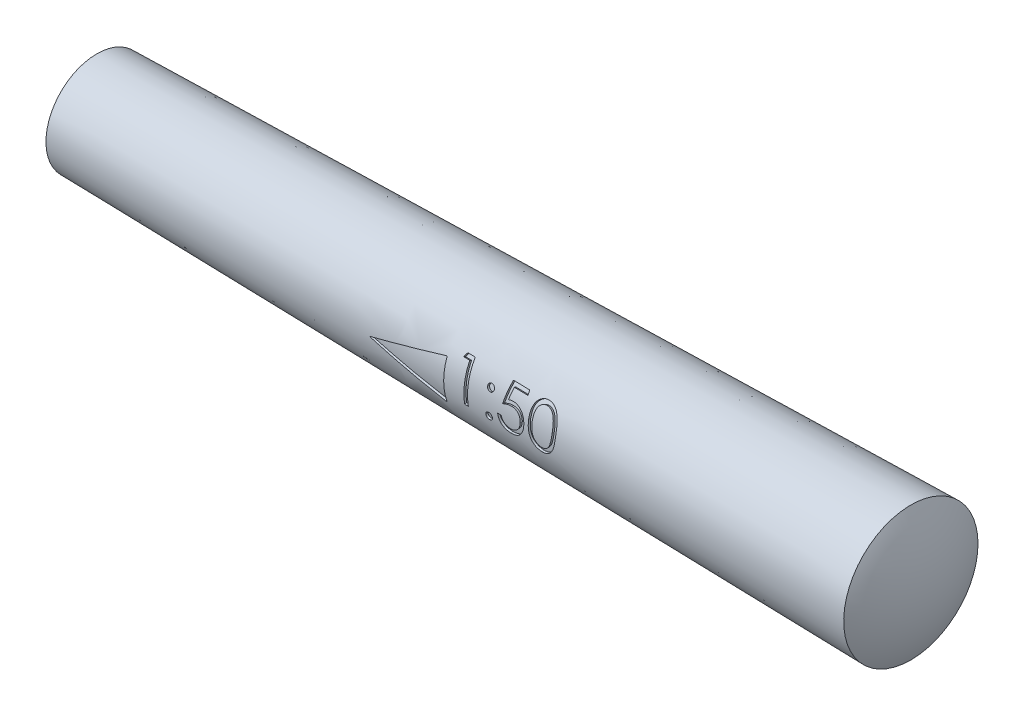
SolidWorks part; units mm, degrees
ref_plane "Front Plane" through (0, 0, 0) normal (0, 0, 1) x (1, 0, 0)
ref_plane "Top Plane" through (0, 0, 0) normal (0, 1, 0) x (1, 0, 0)
ref_plane "Right Plane" through (0, 0, 0) normal (1, 0, 0) x (0, 0, -1)
sketch "Sketch1" plane through (0, 0, 0) normal (1, 0, 0) x (0, 0, -1)
  circle A0 centre (0, 0) radius 1.25
  dimension "D1" = 2.5
extrude "Extrude1" add sketch "Sketch1" along normal mid plane 20
draft "Draft1" type of draft neutral plane draft angle 1.146 faces to draft 1 parameters "D1"=1.146
sketch "Sketch2" plane through (0, 0, 0) normal (0, 0, 1) x (1, 0, 0)
  line L0 (-10, 0) -> (-10, 1.25)
  line L1 (-10, 1.25) -> (-10, -1.25) construction
  line L2 (-10, 0) -> (-10.4, 0)
  line L3 (-10.4, 0) -> (-10.4, -1.45) construction
  line L4 (10, 0) -> (10, 1.65)
  line L5 (10, -1.65) -> (10, 1.65) construction
  line L6 (10, 0) -> (10.4, 0)
  line L7 (10.4, 0) -> (10.4, -1.45) construction
  line L8 (-10, -1.25) -> (10, -1.65) construction
  arc A0 (-10.4, 0) -> (-10, 1.25) centre (-8.2469, 0) cw
  arc A1 (10.4, 0) -> (10, 1.65) centre (6.7968, 0) ccw
  point P14 (0, -1.45)
revolve "Revolve1" add sketch "Sketch2" angle 360 about L2
sketch "Sketch5" plane through (0, 0, 0) normal (0, 0, 1) x (1, 0, 0)
  line L0 (0, 1.45) -> (0, -1.45) construction
  line L1 (10, 1.65) -> (-10, 1.25) construction
  line L2 (-10, -1.25) -> (10, -1.65) construction
ref_plane "Plane2" through (0, 0, 0) normal (-0.02, 0, 0.9998) x (0.9998, 0, 0.02)
sketch "Sketch6" plane through (0, 0, 0) normal (-0.02, 0, 0.9998) x (0.9998, 0, 0.02)
  line L0 (0, 0) -> (0, 0.5)
  line L1 (0, 1.45) -> (0, -1.45) construction
  line L2 (0, 0.5) -> (-1.866, 0)
  line L3 (-1.866, 0) -> (0, -0.5)
  line L4 (0, -0.5) -> (0, 0)
  line L5 (0, -0.25) -> (3, -0.25) construction
  text T0 "1:50" font "Century Gothic" height 1
  dimension "D1" = 1
  dimension "D2" = 30
  dimension "D3" = 3
wrap "Wrap2" sketch "Sketch6" wrap type deboss source sketch "Sketch6" thickness 0.05 parameters "D1"=0.05
equation "\"D2@Sketch2\" = \"D1@Sketch2\""
